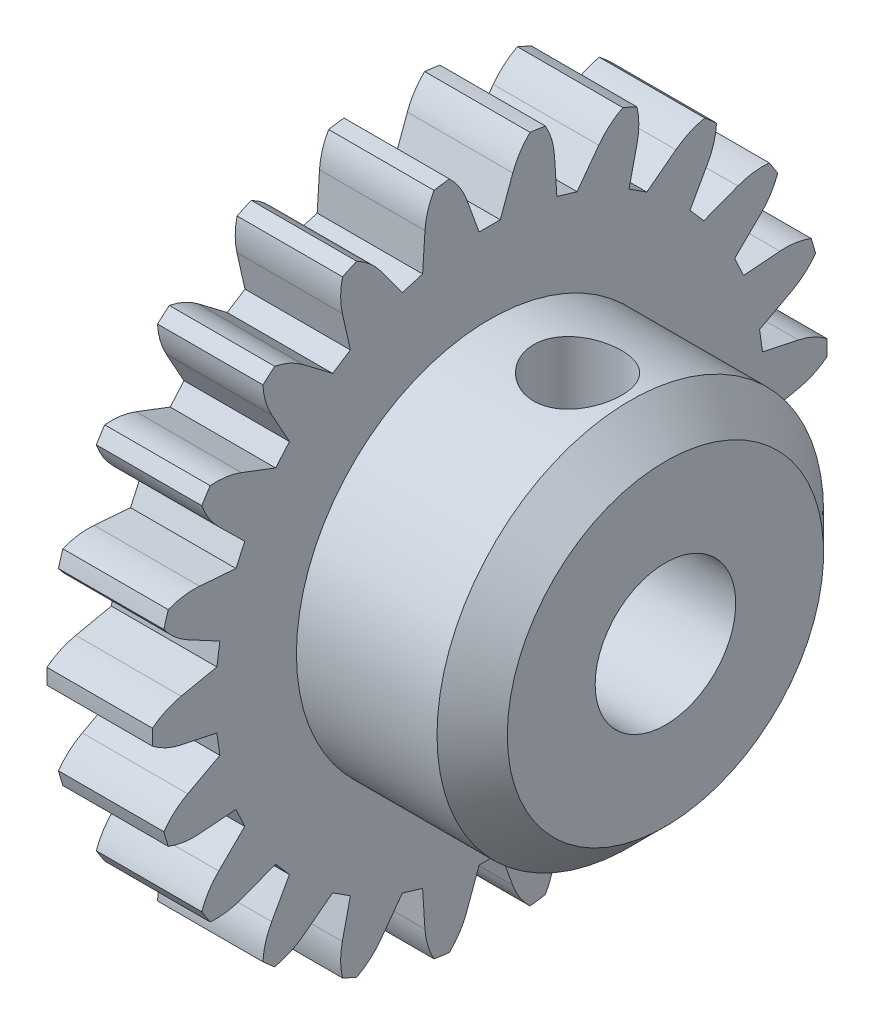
SolidWorks part; units mm, degrees
ref_plane "Plan de face" through (0, 0, 0) normal (0, 0, 1) x (1, 0, 0)
ref_plane "Plan de dessus" through (0, 0, 0) normal (0, 1, 0) x (1, 0, 0)
ref_plane "Plan de droite" through (0, 0, 0) normal (1, 0, 0) x (0, 0, -1)
sketch "Esquisse1" plane through (0, 0, 0) normal (0, 0, 1) x (1, 0, 0)
  line L0 (-19.4483, 0) -> (45.9971, 0) construction
  line L1 (0, 2) -> (8, 2)
  line L3 (0, 2) -> (0, 9.6)
  line L4 (0, 9.6) -> (3, 9.6)
  line L5 (3, 5.5) -> (3, 9.6)
  line L6 (3, 5.5) -> (8, 5.5)
  line L9 (8, 5.5) -> (8, 2)
  dimension "D1" = 2
  dimension "D2" = 3
  dimension "D3" = 5
  dimension "D4" = 9.6
  dimension "D5" = 3.5
revolve "Révolution1" add sketch "Esquisse1" angle 360 about L0
sketch "Esquisse2" plane through (0, 0, 0) normal (-1, 0, 0) x (0, 0, 1)
  line L0 (0, 17.9781) -> (0, -0.7899) construction
  line L1 (-1.4651, 9.781) -> (1.5075, 9.8077)
  line L2 (0.6551, 8.7756) -> (0.3, 7.8)
  line L3 (0.3, 7.8) -> (-0.3009, 7.8)
  line L4 (-0.3009, 7.8) -> (-0.6559, 8.7755)
  arc A0 (1.5075, 9.8077) -> (0.6551, 8.7756) centre (2.5345, 8.0915) ccw
  circle A1 centre (0, 0) radius 8.8 construction
  arc A2 (-0.6559, 8.7755) -> (-1.4651, 9.781) centre (-2.5353, 8.0915) ccw
  dimension "D6" = 17.6
  dimension "D3" = 4
  dimension "D1" = 70
  dimension "D2" = 70
  dimension "D5" = 0.3
extrude "Enlèv. mat.-Extru.1" cut sketch "Esquisse2" against normal through all
pattern_circular "Répétition circulaire1" count 22 over 360 about axis through (0, 0, 0) along (1, 0, 0) of "Enlèv. mat.-Extru.1"
chamfer "Chanfrein1" distance 1 angle 45 1 edges at (8, 0, 5.5)
sketch "Esquisse3" plane through (0, 0, 0) normal (0, 1, 0) x (1, 0, 0)
  line L0 (7, 0) -> (3, 0) construction
  circle A0 centre (5.5, 0) radius 1.25
  dimension "D2" = 2.5
  dimension "D1" = 5.5
extrude "Enlèv. mat.-Extru.2" cut sketch "Esquisse3" along normal blind 20
